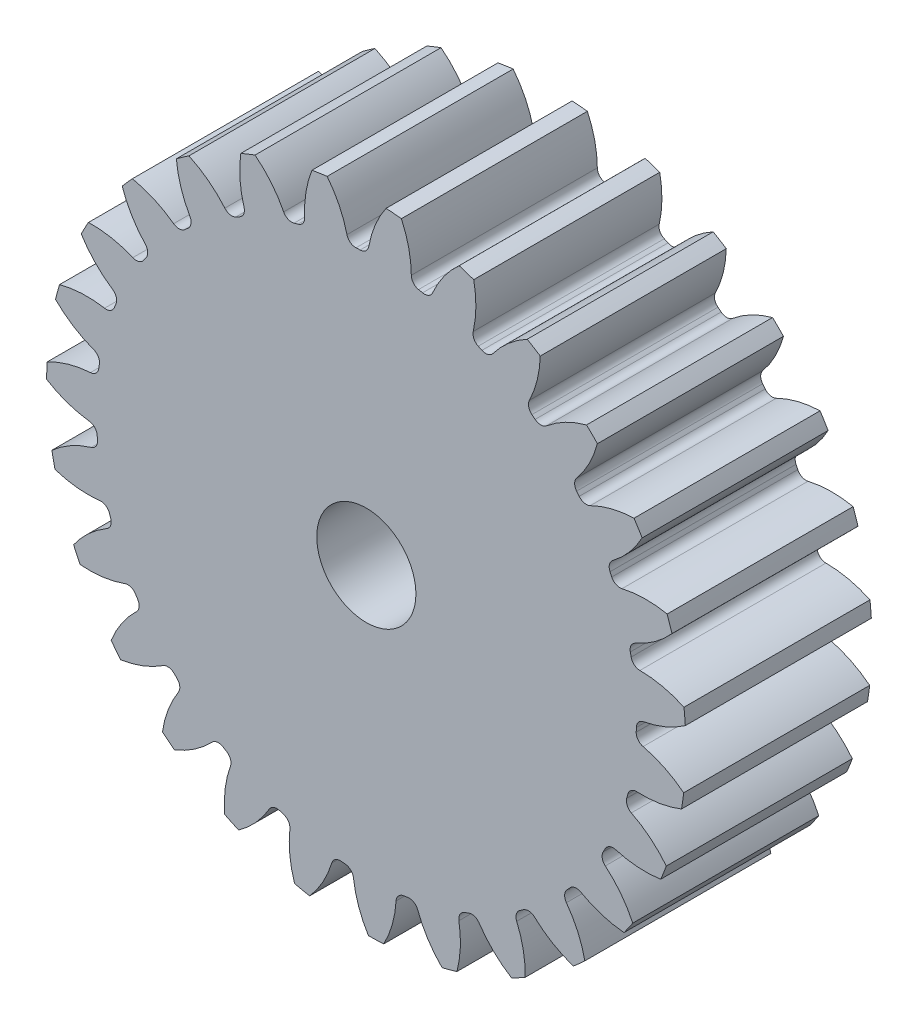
SolidWorks part; units mm, degrees
ref_plane "Front" through (0, 0, 0) normal (0, 0, 1) x (1, 0, 0)
ref_plane "Top" through (0, 0, 0) normal (0, 1, 0) x (1, 0, 0)
ref_plane "Right" through (0, 0, 0) normal (1, 0, 0) x (0, 0, -1)
sketch "Sketch3" plane through (0, 0, 0) normal (0, 0, 1) x (1, 0, 0)
  circle A0 centre (0, 0) radius 163.6889
  dimension "od" = 327.3778
extrude "gearBody" add sketch "Sketch3" along normal blind 95.25
sketch "Sketch2" plane through (0, 0, 0) normal (0, 0, 1) x (1, 0, 0)
  line L0 (0, 0) -> (132.308, 54.8038) construction
  line L1 (162.8397, -19.8588) -> (0, 0) construction
  line L2 (0, 0) -> (36.3143, 0) construction
  line L3 (152.3299, 4.6203) -> (151.8411, -13.0395) construction
  line L5 (152.0855, -4.2096) -> (0, 0) construction
  line L7 (0, 0) -> (143.2092, 0) construction
  arc A0 (143.1968, 1.8822) -> (142.8734, -9.8003) centre (0, 0) ccw construction
  arc A1 (163.3467, 10.5786) -> (162.5114, -19.5981) centre (0, 0) ccw construction
  arc A2 (152.3299, 4.6203) -> (151.8411, -13.0395) centre (0, 0) ccw construction
  arc A3 (138.2028, -4.8799) -> (138.2611, -2.7724) centre (0, 0) ccw
  arc A4 (162.8397, -19.8588) -> (141.7192, -9.509) centre (129.0739, -62.0386) ccw
  arc A5 (162.8397, -19.8588) -> (163.6889, 10.8208) centre (0, 0) ccw
  arc A6 (163.6889, 10.8208) -> (142.0282, 1.6551) centre (132.308, 54.8038) cw
  arc A7 (138.2611, -2.7724) -> (142.0282, 1.6551) centre (142.8548, -2.8645) cw
  arc A8 (141.7192, -9.509) -> (138.2028, -4.8799) centre (142.7945, -5.042) cw
  point P6 (163.6889, 10.8208)
  point P22 (162.8397, -19.8588)
  dimension "baseDia" = 286.4183
  dimension "od" = 327.3778
  dimension "pd" = 304.8
  dimension "rd" = 276.5778
  dimension "rFillet" = 4.5946
  dimension "pointX" = 163.6889
  dimension "pointY" = 10.8208
  dimension "CTT" = 17.6597
  dimension "flankCenterAngle" = 22.5
extrude "toothCut" cut sketch "Sketch2" along normal through all
pattern_circular "CirPattern1" count 27 over 360 about axis through (0, 0, 0) along (0, 0, 1) of "toothCut"
sketch "hub1Dia" plane through (0, 0, 0) normal (0, 0, -1) x (-1, 0, 0)
  circle A0 centre (0, 0) radius 12.7
  dimension "hub1Dia" = 25.4
sketch "hub2Dia" plane through (0, 0, 95.25) normal (0, 0, 1) x (1, 0, 0)
  circle A0 centre (0, 0) radius 12.7
  dimension "hub2dia" = 25.4
sketch "boreDia" plane through (0, 0, 0) normal (0, 0, 1) x (1, 0, 0)
  circle A0 centre (0, 0) radius 25.4
  dimension "boreDia" = 50.8
extrude "bore" cut sketch "boreDia" against normal mid plane 25400
